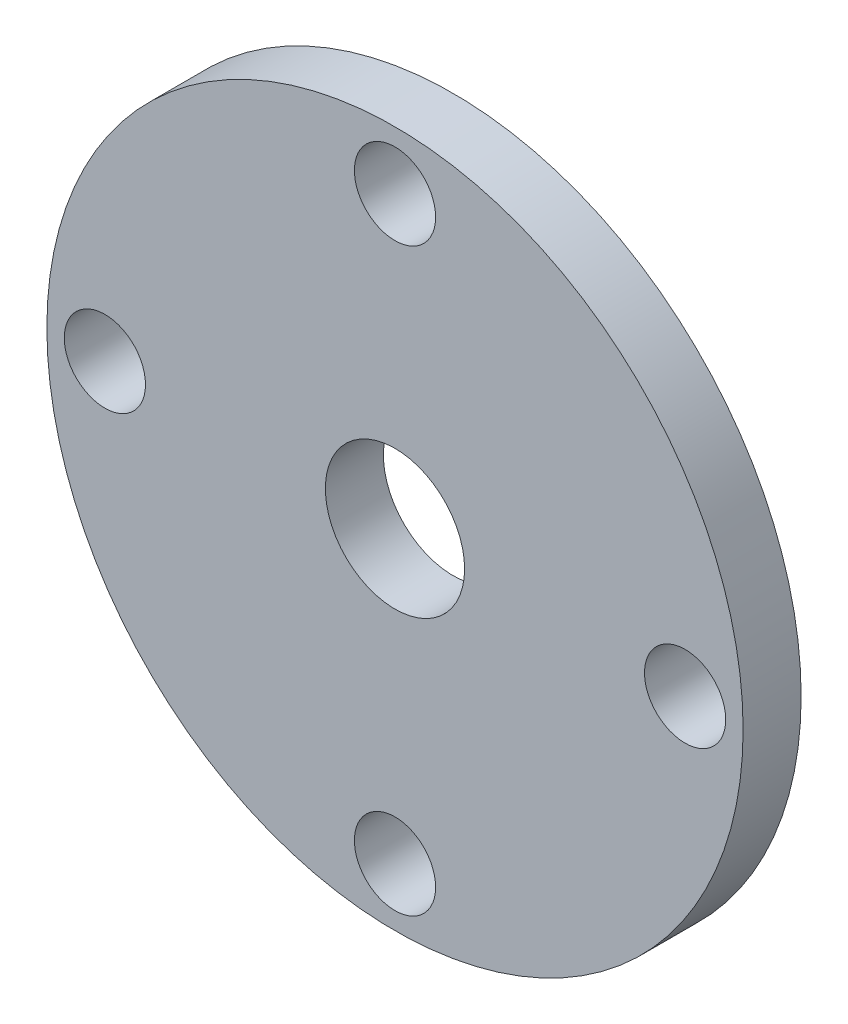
SolidWorks part; units mm, degrees
ref_plane "Front Plane" through (0, 0, 0) normal (0, 0, 1) x (1, 0, 0)
ref_plane "Top Plane" through (0, 0, 0) normal (0, 1, 0) x (1, 0, 0)
ref_plane "Right Plane" through (0, 0, 0) normal (1, 0, 0) x (0, 0, -1)
sketch "Sketch1" plane through (0, 0, 0) normal (0, 0, 1) x (1, 0, 0)
  line L0 (-30, 0) -> (30, 0) construction
  line L1 (0, 30) -> (0, -30) construction
  circle A0 centre (0, 0) radius 30
  circle A1 centre (0, 0) radius 25 construction
  circle A2 centre (0, 0) radius 6
  circle A3 centre (0, 25) radius 3.5
  circle A4 centre (25, 0) radius 3.5
  circle A5 centre (0, -25) radius 3.5
  circle A6 centre (-25, 0) radius 3.5
  dimension "D1" = 60
  dimension "D2" = 50
  dimension "D3" = 12
  dimension "D4" = 7
  dimension "D5" = 7
  dimension "D6" = 7
  dimension "D7" = 7
extrude "Boss-Extrude1" add sketch "Sketch1" along normal blind 5
